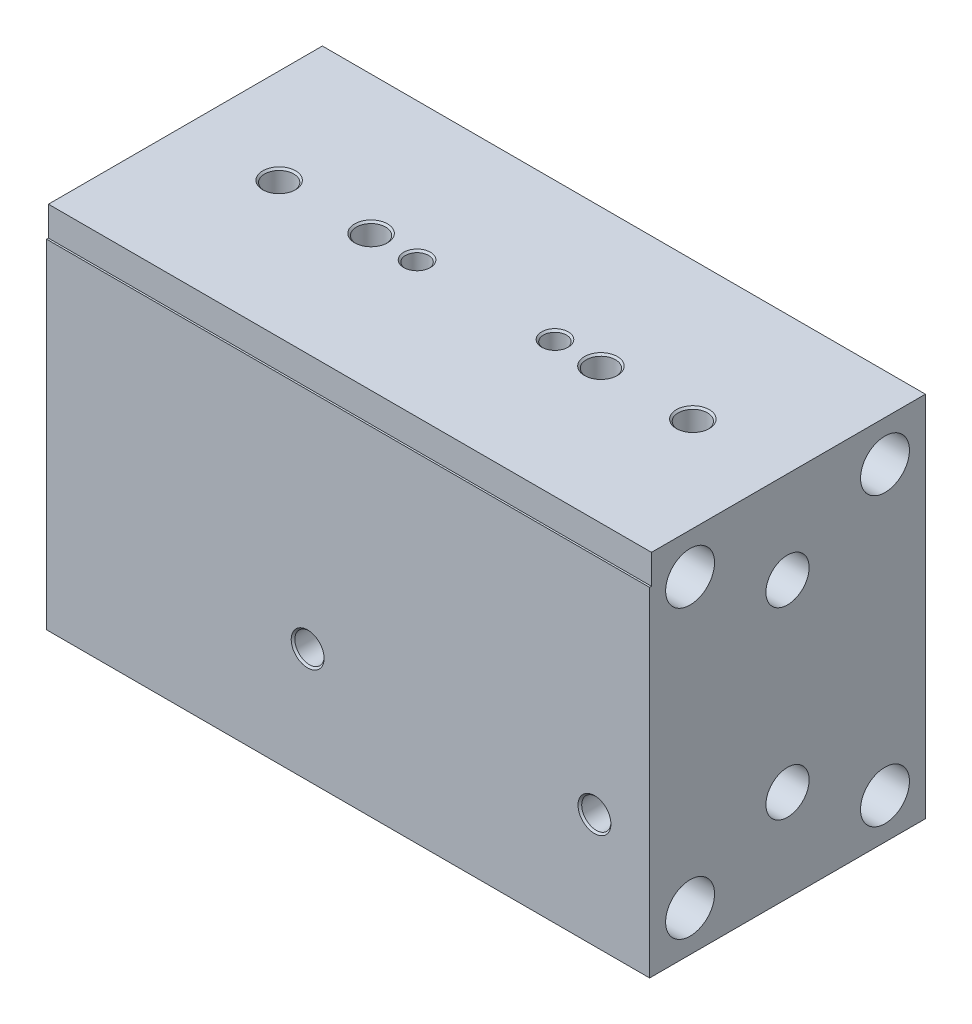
SolidWorks part; units mm, degrees
ref_plane "Front Plane" through (0, 0, 0) normal (0, 0, 1) x (1, 0, 0)
ref_plane "Top Plane" through (0, 0, 0) normal (0, 1, 0) x (1, 0, 0)
ref_plane "Right Plane" through (0, 0, 0) normal (1, 0, 0) x (0, 0, -1)
sketch "Sketch1" plane through (0, 0, 0) normal (0, 0, 1) x (1, 0, 0)
  line L0 (-41.656, -25.4) -> (41.656, -25.4)
  line L1 (41.656, -25.4) -> (41.656, 25.4)
  line L2 (41.656, 25.4) -> (-41.656, 25.4)
  line L3 (-41.656, 25.4) -> (-41.656, -25.4)
  line L4 (-41.656, 25.4) -> (41.656, -25.4) construction
  dimension "D1" = 83.312
  dimension "D2" = 50.8
extrude "Extrude1" add sketch "Sketch1" along normal mid plane 38.1
sketch "Sketch18" plane through (41.656, 0, 0) normal (1, 0, 0) x (0, 0, -1)
  line L0 (-19.05, 25.4) -> (-19.05, 21.336)
  line L1 (-19.05, 21.336) -> (-18.796, 21.336)
  line L2 (-18.796, 21.336) -> (-18.796, 25.4)
  line L3 (-18.796, 25.4) -> (-19.05, 25.4)
  line L4 (-19.05, 25.4) -> (19.05, 25.4) construction
  line L5 (-19.05, -25.4) -> (-19.05, 25.4) construction
  dimension "D1" = 4.064
  dimension "D2" = 0.254
extrude "Cut-Extrude1" cut sketch "Sketch18" against normal through all
hole_wizard "#10-32 Tapped Hole2" positions "Sketch20" profile "Sketch19" tap size "#10-32" standard "ANSI Inch"
sketch "Sketch20" plane through (0, 25.4, 0) normal (0, 1, 0) x (1, 0, 0)
  line L0 (-15.875, 0) -> (15.875, 0) construction
  line L1 (-28.575, 0) -> (-15.875, 0) construction
  line L3 (15.875, 0) -> (28.575, 0) construction
  point P0 (-15.875, 0)
  point P2 (15.875, 0)
  point P8 (-28.575, 0)
  point P10 (28.575, 0)
  dimension "D1" = 31.75
  dimension "D2" = 57.15
sketch "Sketch19" plane through (-15.875, 25.4, 0) normal (1, 0, 0) x (0, 0, 1)
  line L0 (0, 0) -> (0, 11.5257)
  line L1 (0, 11.5257) -> (2.0193, 10.3124)
  line L2 (2.0193, 10.3124) -> (2.0193, 0)
  line L5 (2.0193, 0) -> (0, 0)
  line L10 (0, 11.5257) -> (-2.0193, 10.3124) construction
  line L11 (0, -6.35) -> (0, 107.95) construction
  dimension "Tap Drill Dia." = 4.0386
  dimension "Tap Drill Depth" = 10.3124
  dimension "Drill Angle" = 118
hole_wizard "Hole1" positions "Sketch22" profile "Sketch21" legacy
sketch "Sketch22" plane through (0, 25.4, 0) normal (0, 1, 0) x (1, 0, 0)
  line L0 (-9.525, 0) -> (9.525, 0) construction
  point P0 (-9.525, 0)
  point P2 (9.525, 0)
  dimension "D1" = 19.05
sketch "Sketch21" plane through (-9.525, 25.4, 0) normal (1, 0, 0) x (0, 0, 1)
  line L0 (0, 0) -> (0, 7.3039)
  line L1 (0, 7.3039) -> (1.5875, 6.35)
  line L2 (1.5875, 6.35) -> (1.5875, 0)
  line L4 (1.5875, 0) -> (0, 0)
  line L6 (0, 7.3039) -> (-1.5875, 6.35) construction
  line L7 (0, -4.2442) -> (0, 117.3081) construction
  dimension "Diameter" = 3.175
  dimension "Depth" = 6.35
  dimension "Drill Angle" = 118
hole_wizard "#10-32 Tapped Hole1" positions "Sketch24" profile "Sketch23" tap size "#10-32" standard "ANSI Inch"
sketch "Sketch24" plane through (0, 0, 19.05) normal (0, 0, 1) x (1, 0, 0)
  point P0 (34.036, -9.652)
  point P2 (-5.588, -9.652)
  dimension "D1" = 5.588
  dimension "D2" = 34.036
  dimension "D3" = 9.652
sketch "Sketch23" plane through (34.036, -9.652, 19.05) normal (1, 0, 0) x (0, -1, 0)
  line L0 (0, 0) -> (0, 10.7637)
  line L1 (0, 10.7637) -> (2.0193, 9.5504)
  line L2 (2.0193, 9.5504) -> (2.0193, 0)
  line L5 (2.0193, 0) -> (0, 0)
  line L10 (0, 10.7637) -> (-2.0193, 9.5504) construction
  line L11 (0, -6.35) -> (0, 107.95) construction
  dimension "Tap Drill Dia." = 4.0386
  dimension "Tap Drill Depth" = 9.5504
  dimension "Drill Angle" = 118
hole_wizard "#8-32 Tapped Hole2" positions "Sketch26" profile "Sketch25" tap size "#8-32" standard "ANSI Inch"
sketch "Sketch26" plane through (0, 0, -19.05) normal (0, 0, -1) x (-1, 0, 0)
  line L0 (-25.4, 7.9375) -> (25.4, -7.9375) construction
  point P0 (-25.4, 7.9375)
  point P2 (25.4, 7.9375)
  point P13 (-25.4, -7.9375)
  point P15 (25.4, -7.9375)
  dimension "D1" = 50.8
  dimension "D2" = 15.875
sketch "Sketch25" plane through (25.4, 7.9375, -19.05) normal (1, 0, 0) x (0, 1, 0)
  line L0 (0, 0) -> (0, 11.3502)
  line L1 (0, 11.3502) -> (1.7272, 10.3124)
  line L2 (1.7272, 10.3124) -> (1.7272, 0)
  line L5 (1.7272, 0) -> (0, 0)
  line L10 (0, 11.3502) -> (-1.7272, 10.3124) construction
  line L11 (0, -6.35) -> (0, 107.95) construction
  dimension "Tap Drill Dia." = 3.4544
  dimension "Tap Drill Depth" = 10.3124
  dimension "Drill Angle" = 118
hole_wizard "Hole2" positions "Sketch28" profile "Sketch27" legacy
sketch "Sketch28" plane through (0, 0, -19.05) normal (0, 0, -1) x (-1, 0, 0)
  line L1 (0, 7.9375) -> (0, -7.9375) construction
  point P0 (0, 7.9375)
  point P2 (0, -7.9375)
  dimension "D1" = 15.875
sketch "Sketch27" plane through (0, 7.9375, -19.05) normal (1, 0, 0) x (0, 1, 0)
  line L0 (0, 0) -> (0, 7.3039)
  line L1 (0, 7.3039) -> (1.5875, 6.35)
  line L2 (1.5875, 6.35) -> (1.5875, 0)
  line L4 (1.5875, 0) -> (0, 0)
  line L6 (0, 7.3039) -> (-1.5875, 6.35) construction
  line L7 (0, -4.2442) -> (0, 117.3081) construction
  dimension "Diameter" = 3.175
  dimension "Depth" = 6.35
  dimension "Drill Angle" = 118
sketch "Sketch29" plane through (41.656, 0, 0) normal (1, 0, 0) x (0, 0, -1)
  line L0 (-13.462, 19.812) -> (13.462, -19.812) construction
  line L1 (0, 12.7) -> (0, -12.7) construction
  circle A0 centre (-13.462, 19.812) radius 3.3782
  circle A1 centre (13.462, 19.812) radius 3.3782
  circle A2 centre (-13.462, -19.812) radius 3.3782
  circle A3 centre (13.462, -19.812) radius 3.3782
  circle A4 centre (0, 12.7) radius 2.9845
  circle A5 centre (0, -12.7) radius 2.9845
  dimension "D1" = 39.624
  dimension "D2" = 26.924
  dimension "D3" = 6.7564
  dimension "D4" = 5.969
  dimension "D5" = 25.4
chamfer "Chamfer1" distance 0.254 angle 45 14 edges at (-27.1272, 7.9375, -19.05) (-1.5875, -7.9375, -19.05) (-1.5875, 7.9375, -19.05) (23.6728, 7.9375, -19.05) (-3.5687, -9.652, 19.05) (36.0553, -9.652, 19.05) (15.875, 25.4, 2.0193) (9.525, 25.4, 1.5875) (-9.525, 25.4, 1.5875) (-15.875, 25.4, 2.0193) (28.575, 25.4, 2.0193) (-28.575, 25.4, 2.0193) (-27.1272, -7.9375, -19.05) (23.6728, -7.9375, -19.05)
extrude "Cut-Extrude3" cut sketch "Sketch29" against normal through all
